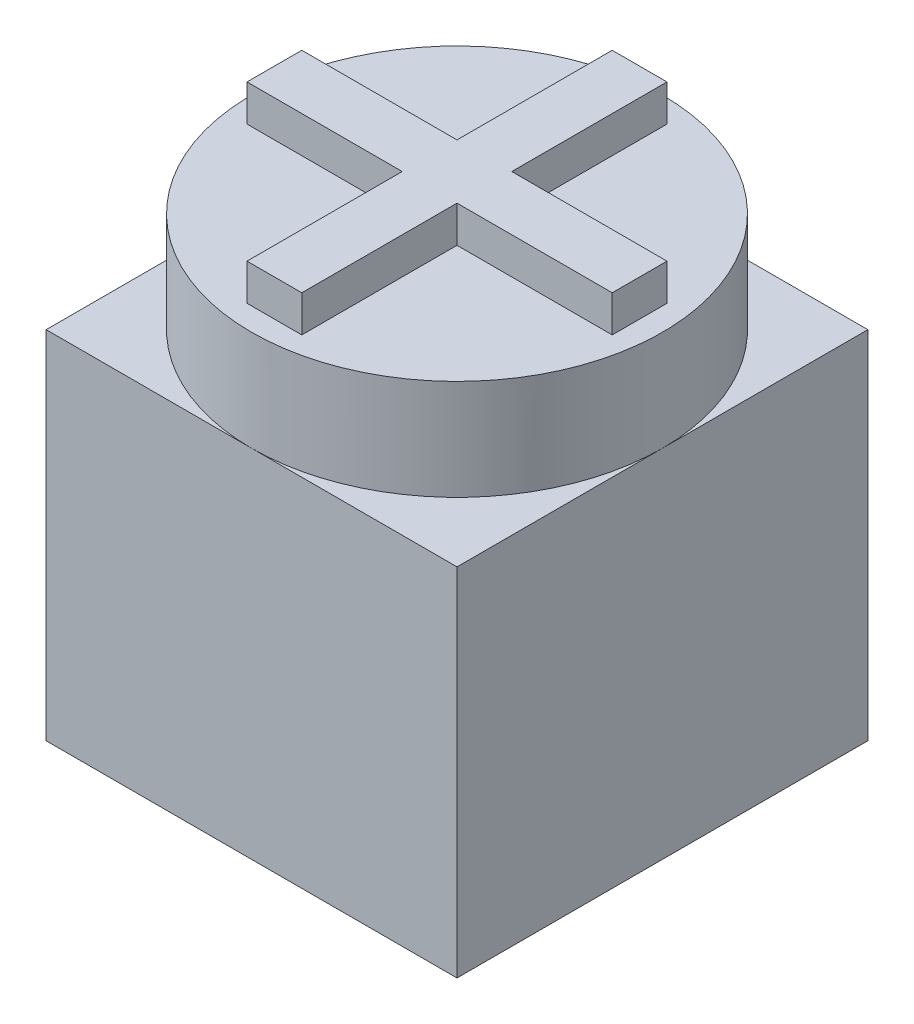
SolidWorks part; units mm, degrees
ref_plane "Plan de face" through (0, 0, 0) normal (0, 0, 1) x (1, 0, 0)
ref_plane "Plan de dessus" through (0, 0, 0) normal (0, 1, 0) x (1, 0, 0)
ref_plane "Plan de droite" through (0, 0, 0) normal (1, 0, 0) x (0, 0, -1)
sketch "Esquisse1" plane through (0, 0, 0) normal (0, 1, 0) x (1, 0, 0)
  line L1 (-4.5, 4.5) -> (4.5, 4.5)
  line L2 (-4.5, 4.5) -> (-4.5, -4.5)
  line L3 (-4.5, -4.5) -> (4.5, -4.5)
  line L4 (4.5, 4.5) -> (4.5, -4.5)
  line L5 (-4.5, 4.5) -> (4.5, -4.5) construction
  line L6 (-4.5, -4.5) -> (4.5, 4.5) construction
  point P0 (0, 0)
  dimension "D1" = 9
  dimension "D2" = 9
extrude "Boss.-Extru.1" add sketch "Esquisse1" along normal blind 7.8
sketch "Esquisse2" plane through (0, 7.8, 0) normal (0, 1, 0) x (1, 0, 0)
  circle A0 centre (0, 0) radius 4.5
extrude "Boss.-Extru.2" add sketch "Esquisse2" along normal blind 2.2
sketch "Esquisse3" plane through (0, 10, 0) normal (0, 1, 0) x (1, 0, 0)
  line L1 (-0.6, 4) -> (0.6, 4)
  line L2 (-0.6, 4) -> (-0.6, -4)
  line L3 (-0.6, -4) -> (0.6, -4)
  line L4 (0.6, 4) -> (0.6, -4)
  line L5 (-0.6, 4) -> (0.6, -4) construction
  line L6 (-0.6, -4) -> (0.6, 4) construction
  line L7 (-4, 0.6) -> (4, 0.6)
  line L8 (-4, 0.6) -> (-4, -0.6)
  line L9 (-4, -0.6) -> (4, -0.6)
  line L10 (4, 0.6) -> (4, -0.6)
  line L11 (-4, 0.6) -> (4, -0.6) construction
  line L12 (-4, -0.6) -> (4, 0.6) construction
  point P0 (0, 0)
  point P8 (0, 0)
  dimension "D1" = 1.2
  dimension "D2" = 1.2
  dimension "D3" = 8
  dimension "D4" = 8
extrude "Boss.-Extru.3" add sketch "Esquisse3" along normal blind 0.8 contours L8 L9 L2 L7 | L2 L7 L4 L1 | L2 L9 L4 L7 | L9 L2 L3 L4 | L10 L7 L4 L9
